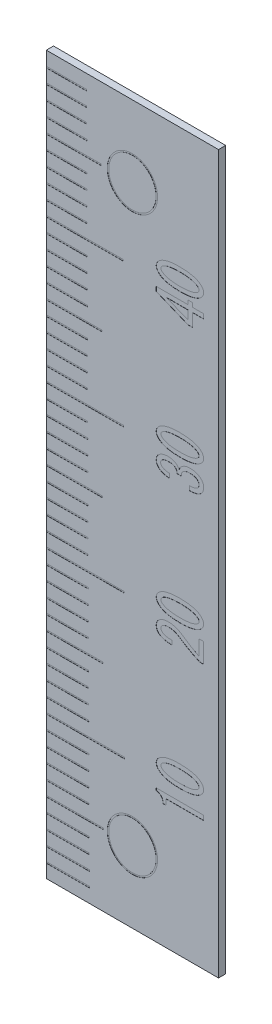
SolidWorks part; units mm, degrees
ref_plane "Front" through (0, 0, 0) normal (0, 0, 1) x (1, 0, 0)
ref_plane "Top" through (0, 0, 0) normal (0, 1, 0) x (1, 0, 0)
ref_plane "Right" through (0, 0, 0) normal (1, 0, 0) x (0, 0, -1)
sketch "Sketch1" plane through (0, 0, 0) normal (0, 0, 1) x (1, 0, 0)
  line L1 (0, 0) -> (0, 50)
  line L2 (0, 0) -> (12, 0)
  line L3 (12, 0) -> (12, 50)
  line L4 (0, 50) -> (12, 50)
  dimension "D1" = 50
  dimension "D2" = 12
extrude "Extrude1" add sketch "Sketch1" along normal blind 0.5
sketch "Sketch2" plane through (0, 0, 0.5) normal (0, 0, 1) x (1, 0, 0)
  line L0 (0, 50) -> (0, 0) construction
  line L1 (0, 0) -> (12, 0) construction
  line L2 (12, 50) -> (0, 50) construction
  circle A0 centre (6, 5) radius 1.75
  circle A1 centre (6, 45) radius 1.75
  circle A2 centre (6, 5) radius 1.65
  circle A3 centre (6, 45) radius 1.65
  dimension "D1" = 6
  dimension "D2" = 6
  dimension "D3" = 5
  dimension "D4" = 5
  dimension "D5" = 3.5
  dimension "D6" = 3.5
  dimension "D7" = 0.1
extrude "Extrude2" cut sketch "Sketch2" against normal blind 0.01
sketch "Sketch3" plane through (0, 0, 0.5) normal (0, 0, 1) x (1, 0, 0)
  line L0 (12, 50) -> (0, 50) construction
  line L1 (7.5, 38.25) -> (11, 38.25) construction
  line L2 (7.5, 38.25) -> (7.5, 41.75) construction
  line L3 (7.5, 41.75) -> (11, 41.75) construction
  line L4 (11, 38.25) -> (11, 41.75) construction
  line L6 (11, 28.25) -> (11, 31.75) construction
  line L7 (11, 18.25) -> (11, 21.75) construction
  line L8 (11, 8.25) -> (11, 11.75) construction
  line L9 (12, 0) -> (12, 50) construction
  text T0 "40" font "ＭＳ ゴシック" height in points 11
  text T1 "30  " font "ＭＳ ゴシック" height in points 11
  text T2 "20" font "ＭＳ ゴシック" height in points 11
  text T3 "10" font "ＭＳ ゴシック" height in points 11
  point P4 (11, 40)
  dimension "D1" = 3.5
  dimension "D2" = 10
  dimension "D3" = 1
  dimension "D4" = 3.5
  dimension "D5" = 4
extrude "Extrude3" cut sketch "Sketch3" against normal blind 0.01
sketch "Sketch4" plane through (0, 0, 0.5) normal (0, 0, 1) x (1, 0, 0)
  line L166 (5.9027, 49.8047) -> (6, 0) construction
  line L167 (0, 0) -> (12, 0) construction
  line L168 (2.9959, 1.0383) -> (2.9963, 0.9383)
  line L169 (-0.0037, 0.9265) -> (2.9963, 0.9383)
  line L210 (-0.0041, 1.0265) -> (2.9959, 1.0383)
  line L211 (-0.0041, 1.0265) -> (-0.0037, 0.9265)
  line L212 (2.992, 2.0383) -> (2.9924, 1.9383)
  line L213 (-0.0076, 1.9265) -> (2.9924, 1.9383)
  line L214 (-0.008, 2.0265) -> (2.992, 2.0383)
  line L215 (-0.008, 2.0265) -> (-0.0076, 1.9265)
  line L216 (2.9881, 3.0383) -> (2.9885, 2.9383)
  line L217 (-0.0115, 2.9265) -> (2.9885, 2.9383)
  line L218 (-0.0119, 3.0265) -> (2.9881, 3.0383)
  line L219 (-0.0119, 3.0265) -> (-0.0115, 2.9265)
  line L220 (2.9842, 4.0382) -> (2.9846, 3.9382)
  line L221 (-0.0154, 3.9265) -> (2.9846, 3.9382)
  line L222 (-0.0158, 4.0265) -> (2.9842, 4.0382)
  line L223 (-0.0158, 4.0265) -> (-0.0154, 3.9265)
  line L224 (2.9764, 6.0382) -> (2.9768, 5.9382)
  line L225 (-0.0232, 5.9265) -> (2.9768, 5.9382)
  line L226 (-0.0236, 6.0265) -> (2.9764, 6.0382)
  line L227 (-0.0236, 6.0265) -> (-0.0232, 5.9265)
  line L228 (2.9725, 7.0382) -> (2.9729, 6.9382)
  line L229 (-0.0271, 6.9265) -> (2.9729, 6.9382)
  line L230 (-0.0275, 7.0265) -> (2.9725, 7.0382)
  line L231 (-0.0275, 7.0265) -> (-0.0271, 6.9265)
  line L232 (2.9686, 8.0382) -> (2.969, 7.9382)
  line L233 (-0.031, 7.9265) -> (2.969, 7.9382)
  line L234 (-0.0314, 8.0265) -> (2.9686, 8.0382)
  line L235 (2.9647, 9.0382) -> (2.9651, 8.9382)
  line L236 (-0.0349, 8.9265) -> (2.9651, 8.9382)
  line L237 (-0.0353, 9.0265) -> (-0.0349, 8.9265)
  line L238 (-0.0353, 9.0265) -> (2.9647, 9.0382)
  line L239 (3.9807, 4.9421) -> (3.9803, 5.0421)
  line L240 (-0.0197, 5.0265) -> (3.9803, 5.0421)
  line L241 (-0.0193, 4.9265) -> (-0.0197, 5.0265)
  line L242 (-0.0193, 4.9265) -> (3.9807, 4.9421)
  line L243 (-0.0314, 8.0265) -> (-0.031, 7.9265)
  line L244 (2.9568, 11.0382) -> (2.9572, 10.9382)
  line L245 (-0.0427, 10.9265) -> (2.9572, 10.9382)
  line L246 (-0.0431, 11.0265) -> (2.9568, 11.0382)
  line L247 (-0.0431, 11.0265) -> (-0.0427, 10.9265)
  line L248 (2.9529, 12.0382) -> (2.9533, 11.9382)
  line L249 (-0.0466, 11.9265) -> (2.9533, 11.9382)
  line L250 (-0.047, 12.0265) -> (2.9529, 12.0382)
  line L251 (-0.047, 12.0265) -> (-0.0466, 11.9265)
  line L252 (2.949, 13.0382) -> (2.9494, 12.9382)
  line L253 (-0.0506, 12.9265) -> (2.9494, 12.9382)
  line L254 (-0.0509, 13.0265) -> (2.949, 13.0382)
  line L255 (-0.0509, 13.0265) -> (-0.0506, 12.9265)
  line L256 (2.9451, 14.0382) -> (2.9455, 13.9382)
  line L257 (-0.0545, 13.9264) -> (2.9455, 13.9382)
  line L258 (-0.0549, 14.0264) -> (2.9451, 14.0382)
  line L259 (-0.0549, 14.0264) -> (-0.0545, 13.9264)
  line L260 (2.9373, 16.0382) -> (2.9377, 15.9382)
  line L261 (-0.0623, 15.9264) -> (2.9377, 15.9382)
  line L262 (-0.0627, 16.0264) -> (2.9373, 16.0382)
  line L263 (-0.0627, 16.0264) -> (-0.0623, 15.9264)
  line L264 (2.9334, 17.0381) -> (2.9338, 16.9381)
  line L265 (-0.0662, 16.9264) -> (2.9338, 16.9381)
  line L266 (-0.0666, 17.0264) -> (2.9334, 17.0381)
  line L267 (-0.0666, 17.0264) -> (-0.0662, 16.9264)
  line L268 (2.9295, 18.0381) -> (2.9299, 17.9381)
  line L269 (-0.0701, 17.9264) -> (2.9299, 17.9381)
  line L270 (-0.0705, 18.0264) -> (2.9295, 18.0381)
  line L271 (2.9256, 19.0381) -> (2.926, 18.9381)
  line L272 (-0.074, 18.9264) -> (2.926, 18.9381)
  line L273 (-0.0744, 19.0264) -> (-0.074, 18.9264)
  line L274 (-0.0744, 19.0264) -> (2.9256, 19.0381)
  line L275 (3.9416, 14.9421) -> (3.9412, 15.0421)
  line L276 (-0.0588, 15.0264) -> (3.9412, 15.0421)
  line L277 (-0.0584, 14.9264) -> (-0.0588, 15.0264)
  line L278 (-0.0584, 14.9264) -> (3.9416, 14.9421)
  line L279 (-0.0705, 18.0264) -> (-0.0701, 17.9264)
  line L280 (-0.0388, 9.9265) -> (-0.0392, 10.0265)
  line L281 (5.4611, 9.948) -> (-0.0388, 9.9265)
  line L282 (5.4607, 10.048) -> (5.4611, 9.948)
  line L283 (-0.0392, 10.0265) -> (5.4607, 10.048)
  line L284 (2.9178, 21.0381) -> (2.9182, 20.9381)
  line L285 (-0.0818, 20.9264) -> (2.9182, 20.9381)
  line L286 (-0.0822, 21.0264) -> (2.9178, 21.0381)
  line L287 (-0.0822, 21.0264) -> (-0.0818, 20.9264)
  line L288 (2.9139, 22.0381) -> (2.9143, 21.9381)
  line L289 (-0.0857, 21.9264) -> (2.9143, 21.9381)
  line L290 (-0.0861, 22.0264) -> (2.9139, 22.0381)
  line L291 (-0.0861, 22.0264) -> (-0.0857, 21.9264)
  line L292 (2.91, 23.0381) -> (2.9104, 22.9381)
  line L293 (-0.0896, 22.9264) -> (2.9104, 22.9381)
  line L294 (-0.09, 23.0264) -> (2.91, 23.0381)
  line L295 (-0.09, 23.0264) -> (-0.0896, 22.9264)
  line L296 (2.9061, 24.0381) -> (2.9064, 23.9381)
  line L297 (-0.0935, 23.9264) -> (2.9064, 23.9381)
  line L298 (-0.0939, 24.0264) -> (2.9061, 24.0381)
  line L299 (-0.0939, 24.0264) -> (-0.0935, 23.9264)
  line L300 (2.8982, 26.0381) -> (2.8986, 25.9381)
  line L301 (-0.1013, 25.9264) -> (2.8986, 25.9381)
  line L302 (-0.1017, 26.0264) -> (2.8982, 26.0381)
  line L303 (-0.1017, 26.0264) -> (-0.1013, 25.9264)
  line L304 (2.8943, 27.0381) -> (2.8947, 26.9381)
  line L305 (-0.1053, 26.9264) -> (2.8947, 26.9381)
  line L306 (-0.1056, 27.0263) -> (2.8943, 27.0381)
  line L307 (-0.1056, 27.0263) -> (-0.1053, 26.9264)
  line L308 (2.8904, 28.0381) -> (2.8908, 27.9381)
  line L309 (-0.1092, 27.9263) -> (2.8908, 27.9381)
  line L310 (-0.1096, 28.0263) -> (2.8904, 28.0381)
  line L311 (2.8865, 29.0381) -> (2.8869, 28.9381)
  line L312 (-0.1131, 28.9263) -> (2.8869, 28.9381)
  line L313 (-0.1135, 29.0263) -> (-0.1131, 28.9263)
  line L314 (-0.1135, 29.0263) -> (2.8865, 29.0381)
  line L315 (3.9025, 24.942) -> (3.9021, 25.042)
  line L316 (-0.0978, 25.0264) -> (3.9021, 25.042)
  line L317 (-0.0974, 24.9264) -> (-0.0978, 25.0264)
  line L318 (-0.0974, 24.9264) -> (3.9025, 24.942)
  line L319 (-0.1096, 28.0263) -> (-0.1092, 27.9263)
  line L320 (-0.0779, 19.9264) -> (-0.0783, 20.0264)
  line L321 (5.4221, 19.9479) -> (-0.0779, 19.9264)
  line L322 (5.4217, 20.0479) -> (5.4221, 19.9479)
  line L323 (-0.0783, 20.0264) -> (5.4217, 20.0479)
  line L324 (2.8787, 31.038) -> (2.8791, 30.938)
  line L325 (-0.1209, 30.9263) -> (2.8791, 30.938)
  line L326 (-0.1213, 31.0263) -> (2.8787, 31.038)
  line L327 (-0.1213, 31.0263) -> (-0.1209, 30.9263)
  line L328 (2.8748, 32.038) -> (2.8752, 31.938)
  line L329 (-0.1248, 31.9263) -> (2.8752, 31.938)
  line L330 (-0.1252, 32.0263) -> (2.8748, 32.038)
  line L331 (-0.1252, 32.0263) -> (-0.1248, 31.9263)
  line L332 (2.8709, 33.038) -> (2.8713, 32.938)
  line L333 (-0.1287, 32.9263) -> (2.8713, 32.938)
  line L334 (-0.1291, 33.0263) -> (2.8709, 33.038)
  line L335 (-0.1291, 33.0263) -> (-0.1287, 32.9263)
  line L336 (2.867, 34.038) -> (2.8674, 33.938)
  line L337 (-0.1326, 33.9263) -> (2.8674, 33.938)
  line L338 (-0.133, 34.0263) -> (2.867, 34.038)
  line L339 (-0.133, 34.0263) -> (-0.1326, 33.9263)
  line L340 (2.8592, 36.038) -> (2.8596, 35.938)
  line L341 (-0.1404, 35.9263) -> (2.8596, 35.938)
  line L342 (-0.1408, 36.0263) -> (2.8592, 36.038)
  line L343 (-0.1408, 36.0263) -> (-0.1404, 35.9263)
  line L344 (2.8553, 37.038) -> (2.8556, 36.938)
  line L345 (-0.1443, 36.9263) -> (2.8556, 36.938)
  line L346 (-0.1447, 37.0263) -> (2.8553, 37.038)
  line L347 (-0.1447, 37.0263) -> (-0.1443, 36.9263)
  line L348 (2.8513, 38.038) -> (2.8517, 37.938)
  line L349 (-0.1482, 37.9263) -> (2.8517, 37.938)
  line L350 (-0.1486, 38.0263) -> (2.8513, 38.038)
  line L351 (2.8474, 39.038) -> (2.8478, 38.938)
  line L352 (-0.1521, 38.9263) -> (2.8478, 38.938)
  line L353 (-0.1525, 39.0263) -> (-0.1521, 38.9263)
  line L354 (-0.1525, 39.0263) -> (2.8474, 39.038)
  line L355 (3.8635, 34.9419) -> (3.8631, 35.0419)
  line L356 (-0.1369, 35.0263) -> (3.8631, 35.0419)
  line L357 (-0.1365, 34.9263) -> (-0.1369, 35.0263)
  line L358 (-0.1365, 34.9263) -> (3.8635, 34.9419)
  line L359 (-0.1486, 38.0263) -> (-0.1482, 37.9263)
  line L360 (2.8396, 41.038) -> (2.84, 40.938)
  line L361 (-0.16, 40.9262) -> (2.84, 40.938)
  line L362 (-0.1603, 41.0262) -> (2.8396, 41.038)
  line L363 (-0.1603, 41.0262) -> (-0.16, 40.9262)
  line L364 (2.8357, 42.038) -> (2.8361, 41.938)
  line L365 (-0.1639, 41.9262) -> (2.8361, 41.938)
  line L366 (-0.1643, 42.0262) -> (2.8357, 42.038)
  line L367 (-0.1643, 42.0262) -> (-0.1639, 41.9262)
  line L368 (2.8318, 43.0379) -> (2.8322, 42.938)
  line L369 (-0.1678, 42.9262) -> (2.8322, 42.938)
  line L370 (-0.1682, 43.0262) -> (2.8318, 43.0379)
  line L371 (-0.1682, 43.0262) -> (-0.1678, 42.9262)
  line L372 (2.8279, 44.0379) -> (2.8283, 43.9379)
  line L373 (-0.1717, 43.9262) -> (2.8283, 43.9379)
  line L374 (-0.1721, 44.0262) -> (2.8279, 44.0379)
  line L375 (-0.1721, 44.0262) -> (-0.1717, 43.9262)
  line L376 (-0.117, 29.9263) -> (-0.1174, 30.0263)
  line L377 (5.383, 29.9478) -> (-0.117, 29.9263)
  line L378 (5.3826, 30.0478) -> (5.383, 29.9478)
  line L379 (-0.1174, 30.0263) -> (5.3826, 30.0478)
  line L380 (2.8201, 46.0379) -> (2.8205, 45.9379)
  line L381 (-0.1795, 45.9262) -> (2.8205, 45.9379)
  line L382 (-0.1799, 46.0262) -> (2.8201, 46.0379)
  line L383 (-0.1799, 46.0262) -> (-0.1795, 45.9262)
  line L384 (2.8162, 47.0379) -> (2.8166, 46.9379)
  line L385 (-0.1834, 46.9262) -> (2.8166, 46.9379)
  line L386 (-0.1838, 47.0262) -> (2.8162, 47.0379)
  line L387 (-0.1838, 47.0262) -> (-0.1834, 46.9262)
  line L388 (2.8123, 48.0379) -> (2.8127, 47.9379)
  line L389 (-0.1873, 47.9262) -> (2.8127, 47.9379)
  line L390 (-0.1877, 48.0262) -> (2.8123, 48.0379)
  line L391 (2.8084, 49.0379) -> (2.8088, 48.9379)
  line L392 (-0.1912, 48.9262) -> (2.8088, 48.9379)
  line L393 (-0.1916, 49.0262) -> (-0.1912, 48.9262)
  line L394 (-0.1916, 49.0262) -> (2.8084, 49.0379)
  line L395 (3.8244, 44.9418) -> (3.824, 45.0418)
  line L396 (-0.176, 45.0262) -> (3.824, 45.0418)
  line L397 (-0.1756, 44.9262) -> (-0.176, 45.0262)
  line L398 (-0.1756, 44.9262) -> (3.8244, 44.9418)
  line L399 (-0.1877, 48.0262) -> (-0.1873, 47.9262)
  line L400 (-0.1561, 39.9263) -> (-0.1564, 40.0263)
  line L401 (5.3439, 39.9477) -> (-0.1561, 39.9263)
  line L402 (5.3435, 40.0477) -> (5.3439, 39.9477)
  line L403 (-0.1564, 40.0263) -> (5.3435, 40.0477)
extrude "Extrude4" cut sketch "Sketch4" against normal blind 0.01
move or copy body "Body-Move/Copy2" bodies to move or copy 105 copy no translate (-12, 0, 0)
